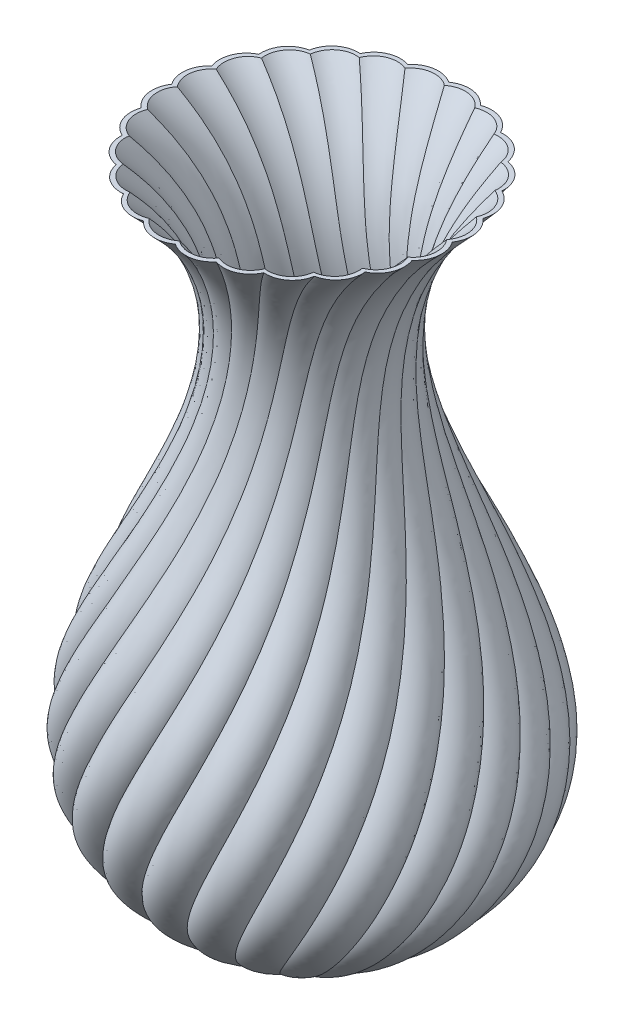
SolidWorks part; units mm, degrees
ref_plane "Front Plane" through (0, 0, 0) normal (0, 0, 1) x (1, 0, 0)
ref_plane "Top Plane" through (0, 0, 0) normal (0, 1, 0) x (1, 0, 0)
ref_plane "Right Plane" through (0, 0, 0) normal (1, 0, 0) x (0, 0, -1)
sketch "Sketch1" plane through (0, 0, 0) normal (0, 0, 1) x (1, 0, 0)
  line L0 (0, 0) -> (0, 300) construction
  line L1 (0, 0) -> (35, 0)
  line L2 (60, 300) -> (0, 300)
  line L3 (0, 300) -> (0, 0)
  spline S0 degree 3 poles (35, 0) (167.6754, 87.2326) (-44.8851, 196.1056) (60, 300) knots 0 0 0 0 1 1 1 1
  dimension "D1" = 300
  dimension "D2" = 35
  dimension "D3" = 60
  dimension "D4" = 200
  dimension "D5" = 35
  dimension "D6" = 75
  dimension "D7" = 80
revolve "Revolve1" add sketch "Sketch1" angle 360 about L0
sketch "Sketch2" plane through (0, 0, 0) normal (0, 1, 0) x (1, 0, 0)
  circle A0 centre (30, 0) radius 12.5
  point P2 (0, 0)
  point P4 (0, 0)
  dimension "D1" = 25
  dimension "D2" = 30
sketch "Sketch3" plane through (0, 0, 0) normal (0, 0, 1) x (1, 0, 0)
  spline S0 degree 3 number of poles 128 (35, 0) -> (60, 300) construction
  spline S1 degree 3 number of poles 128 (35, 0) -> (60, 300)
sweep "Sweep1" add profiles "Sketch2" path "Sketch3"
pattern_circular "CirPattern1" count 24 over 360 of "Sweep1"
other "Flex1" parameters "D0"=90, "D1"=0, "D2"=0
shell "Shell1" thickness 1.5
